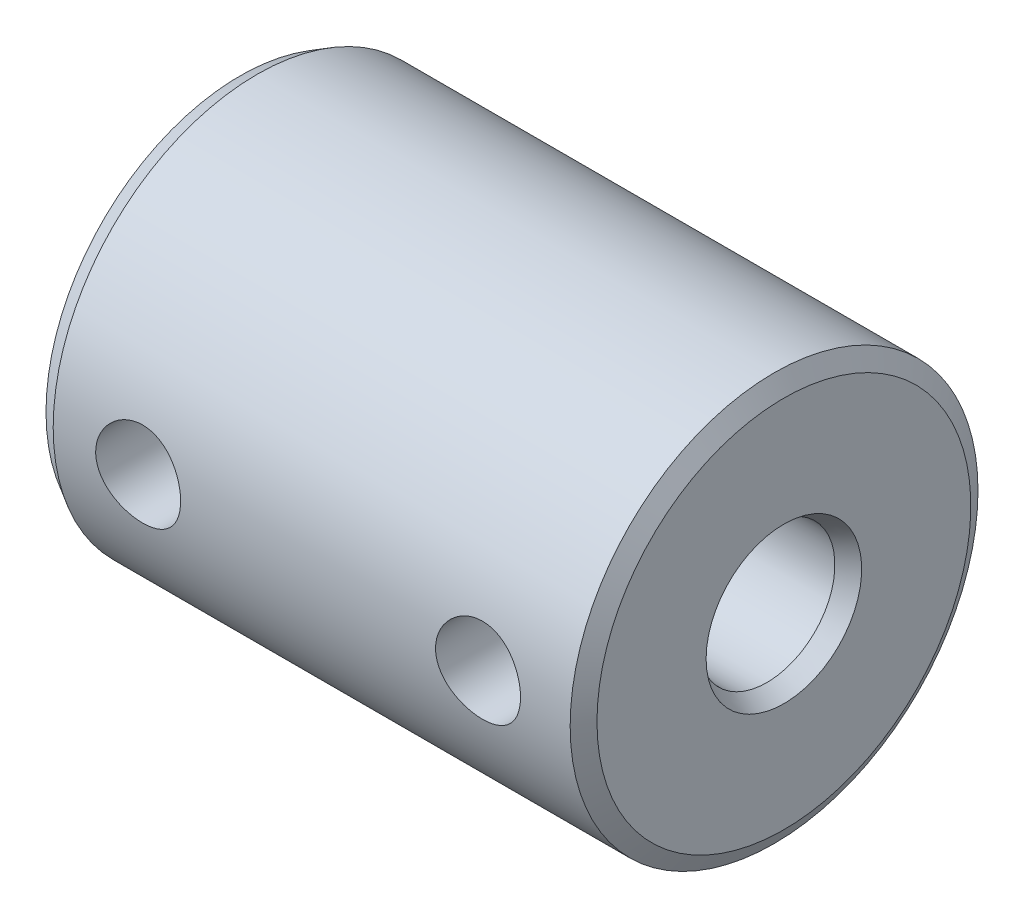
SolidWorks part; units mm, degrees
ref_plane "Plan de face" through (0, 0, 0) normal (0, 0, 1) x (1, 0, 0)
ref_plane "Plan de dessus" through (0, 0, 0) normal (0, 1, 0) x (1, 0, 0)
ref_plane "Plan de droite" through (0, 0, 0) normal (1, 0, 0) x (0, 0, -1)
sketch "Esquisse1" plane through (0, 0, 0) normal (0, 0, 1) x (1, 0, 0)
  line L0 (0, 0) -> (42.0718, 0) construction
  line L1 (0, 3) -> (0, 6)
  line L2 (0, 6) -> (16, 6)
  line L3 (16, 6) -> (16, 2)
  line L4 (16, 2) -> (8, 2)
  line L5 (8, 2) -> (8, 3)
  line L6 (8, 3) -> (0, 3)
  dimension "D1" = 4
  dimension "D2" = 6
  dimension "D3" = 8
  dimension "D4" = 16
  dimension "D5" = 12
revolve "Révolution1" add sketch "Esquisse1" angle 360 about L0
chamfer "Chanfrein1" distance 0.5 angle 30 4 edges at (0, 0, 3) (0, 0, 6) (16, 0, 6) (16, 0, 2)
hole_wizard "Trou taraudé M31" positions "Esquisse3" profile "Esquisse2" tap size "M3" standard "ISO"
sketch "Esquisse3" plane through (0, 0, 0) normal (0, 0, 1) x (1, 0, 0)
  line L0 (0, 0) -> (16, 0) construction
  line L1 (16, -5.5) -> (16, 5.5) construction
  line L2 (0, 5.7113) -> (0, -5.7113) construction
  point P0 (3, 0)
  point P10 (13, 0)
  dimension "D1" = 3
  dimension "D2" = 3
sketch "Esquisse2" plane through (3, 0, 0) normal (1, 0, 0) x (0, 1, 0)
  line L0 (0, 0) -> (0, 6)
  line L1 (0, 6) -> (1.25, 6)
  line L2 (1.25, 6) -> (1.25, 0)
  line L5 (1.25, 0) -> (0, 0)
  line L11 (0, -6.35) -> (0, 107.95) construction
  dimension "Diamètre du trou pour taraudage jusqu'au prochain" = 2.5
  dimension "Profondeur du trou pour taraudage jusqu'au prochain" = 6
